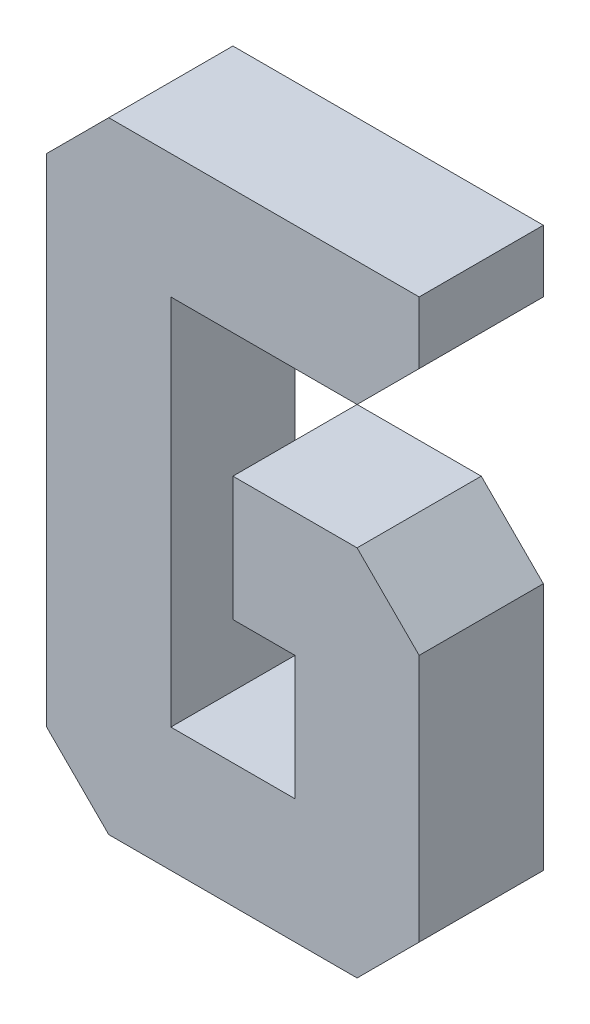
SolidWorks part; units mm, degrees
ref_plane "Plan de face" through (0, 0, 0) normal (0, 0, 1) x (1, 0, 0)
ref_plane "Plan de dessus" through (0, 0, 0) normal (0, 1, 0) x (1, 0, 0)
ref_plane "Plan de droite" through (0, 0, 0) normal (1, 0, 0) x (0, 0, -1)
sketch "Esquisse1" plane through (0, 0, 0) normal (0, 0, 1) x (1, 0, 0)
  line L1 (0, 0) -> (10, 0)
  line L2 (0, 0) -> (0, 50)
  line L3 (0, 50) -> (10, 50)
  line L4 (10, 10) -> (10, 40)
  line L5 (0, 50) -> (30, 50)
  line L6 (0, 50) -> (0, 40)
  line L7 (10, 40) -> (30, 40)
  line L8 (30, 50) -> (30, 40)
  line L9 (0, 0) -> (30, 0)
  line L10 (0, 0) -> (0, 10)
  line L11 (10, 10) -> (20, 10)
  line L12 (30, 0) -> (30, 10)
  line L14 (30, 10) -> (30, 30)
  line L15 (30, 30) -> (20, 30)
  line L16 (20, 10) -> (20, 20)
  line L17 (20, 30) -> (15, 30)
  line L19 (20, 20) -> (15, 20)
  line L20 (15, 30) -> (15, 20)
  dimension "D1" = 30
  dimension "D2" = 50
  dimension "D3" = 10
  dimension "D4" = 30
  dimension "D5" = 10
  dimension "D6" = 10
  dimension "D7" = 10
  dimension "D8" = 30
  dimension "D9" = 10
  dimension "D10" = 5
extrude "Boss.-Extru.1" add sketch "Esquisse1" along normal blind 10 contours L17 L20 L19 L16 L11 L4 L7 L8 L5 L3 L2 L1 L9 L12 L14 L15
chamfer "Chanfrein1" distance 5 angle 45 1 edges at (30, 30, 5)
chamfer "Chanfrein2" distance 5 angle 45 1 edges at (30, 0, 5)
chamfer "Chanfrein3" distance 5 angle 45 1 edges at (0, 50, 5)
chamfer "Chanfrein4" distance 5 angle 45 1 edges at (30, 40, 5)
chamfer "Chanfrein5" distance 5 angle 45 1 edges at (0, 0, 5)
